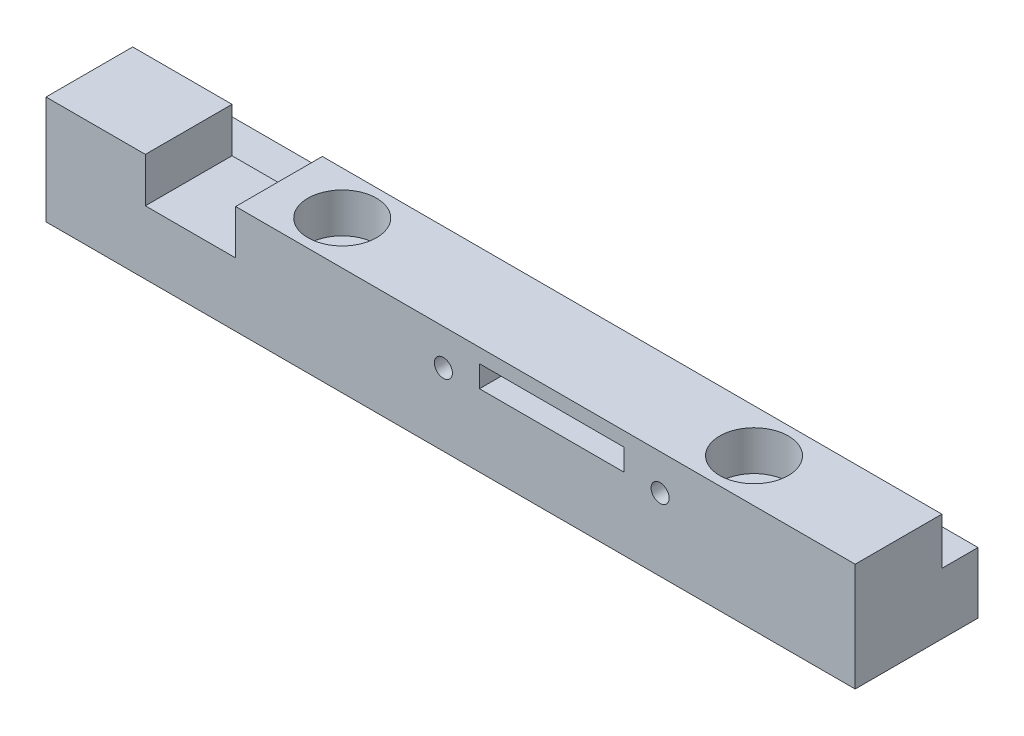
SolidWorks part; units mm, degrees
ref_plane "前视基准面" through (0, 0, 0) normal (0, 0, 1) x (1, 0, 0)
ref_plane "上视基准面" through (0, 0, 0) normal (0, 1, 0) x (1, 0, 0)
ref_plane "右视基准面" through (0, 0, 0) normal (1, 0, 0) x (0, 0, -1)
sketch "草图1" plane through (0, 0, 0) normal (0, 0, 1) x (1, 0, 0)
  line L0 (0, 0) -> (0, 15)
  line L1 (112, 0) -> (112, 15)
  line L2 (0, 0) -> (112, 0)
  line L3 (0, 15) -> (112, 15)
extrude "凸台-拉伸1" add sketch "草图1" along normal blind 17
sketch "草图2" plane through (112, 0, 0) normal (1, 0, 0) x (0, 0, -1)
  line L0 (-5, 8.4689) -> (-5, 14.9689)
  line L1 (-5, 8.4689) -> (0, 8.4689)
  line L2 (-17, 14.9689) -> (-5, 14.9689)
  line L3 (-17, -0.0311) -> (0, -0.0311)
  line L4 (0, -0.0311) -> (0, 8.4689)
  line L5 (-17, -0.0311) -> (-17, 14.9689)
extrude "切除-拉伸1" cut sketch "草图2" against normal up to next (112 mm away) flip side to cut
sketch "草图3" plane through (0, 0, 17) normal (0, 0, 1) x (1, 0, 0)
  circle A0 centre (85, 10) radius 1.25
  circle A1 centre (55, 10) radius 1.25
extrude "切除-拉伸2" cut sketch "草图3" against normal blind 8
sketch "草图4" plane through (0, 14.9689, 0) normal (0, 1, 0) x (1, 0, 0)
  circle A0 centre (35, -11) radius 2.75
  circle A1 centre (92, -11) radius 2.75
extrude "切除-拉伸3" cut sketch "草图4" against normal through all
sketch "草图5" plane through (0, 14.9689, 0) normal (0, 1, 0) x (1, 0, 0)
  circle A0 centre (35, -11) radius 4.75
  circle A1 centre (92, -11) radius 4.75
extrude "切除-拉伸4" cut sketch "草图5" against normal blind 5.5
sketch "草图6" plane through (0, 0, 17) normal (0, 0, 1) x (1, 0, 0)
  line L0 (60, 13) -> (80, 13)
  line L1 (60, 10) -> (80, 10)
  line L2 (60, 10) -> (60, 13)
  line L3 (80, 10) -> (80, 13)
extrude "切除-拉伸5" cut sketch "草图6" against normal through all
sketch "草图7" plane through (0, 0, 17) normal (0, 0, 1) x (1, 0, 0)
  line L0 (13.75, 15) -> (13.75, 8.8)
  line L1 (26.25, 15) -> (26.25, 8.8)
  line L2 (13.75, 8.8) -> (26.25, 8.8)
extrude "切除-拉伸6" cut sketch "草图7" against normal through all and the other way through all flip side to cut
